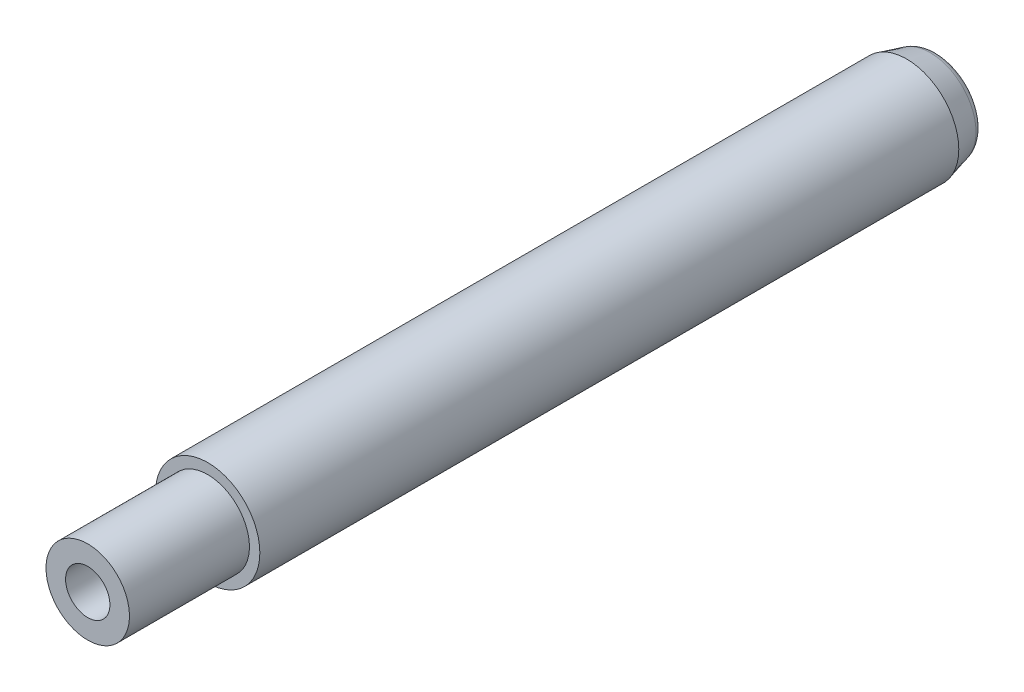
SolidWorks part; units mm, degrees
ref_plane "Face" through (0, 0, 0) normal (0, 0, 1) x (1, 0, 0)
ref_plane "Dessus" through (0, 0, 0) normal (0, 1, 0) x (1, 0, 0)
ref_plane "Droite" through (0, 0, 0) normal (1, 0, 0) x (0, 0, -1)
sketch "Esquisse1" plane through (0, 0, 0) normal (0, 0, 1) x (1, 0, 0)
  circle A0 centre (0, 0) radius 8
  dimension "D1" = 16
extrude "Base-Extrusion" add sketch "Esquisse1" along normal blind 23
sketch "Esquisse4"
  circle A0 centre (0, 0) radius 10
  dimension "D1" = 20
hole_wizard "Trou taraudé M10x1.51" positions "Esquisse3" profile "Esquisse2" tap size "M10x1.5" standard "ISO"
sketch "Esquisse3" plane through (0, 0, 23) normal (0, 0, 1) x (1, 0, 0)
  point P1 (0, 0)
sketch "Esquisse2" plane through (0, 0, 23) normal (1, 0, 0) x (0, -1, 0)
  line L0 (0, 0) -> (0, 29.5537)
  line L1 (0, 29.5537) -> (4.25, 27)
  line L2 (4.25, 27) -> (4.25, 0)
  line L5 (4.25, 0) -> (0, 0)
  line L10 (0, 29.5537) -> (-4.25, 27) construction
  line L11 (0, -6.35) -> (0, 107.95) construction
  dimension "Diamètre du perçage" = 8.5
  dimension "Profondeur du perçage" = 27
  dimension "Angle de pointe" = 118
extrude "Boss.-Extru.1" add sketch "Esquisse4" along normal blind 140
chamfer "Chanfrein1" distance 6 angle 15
fillet "Congé1" radius 2
